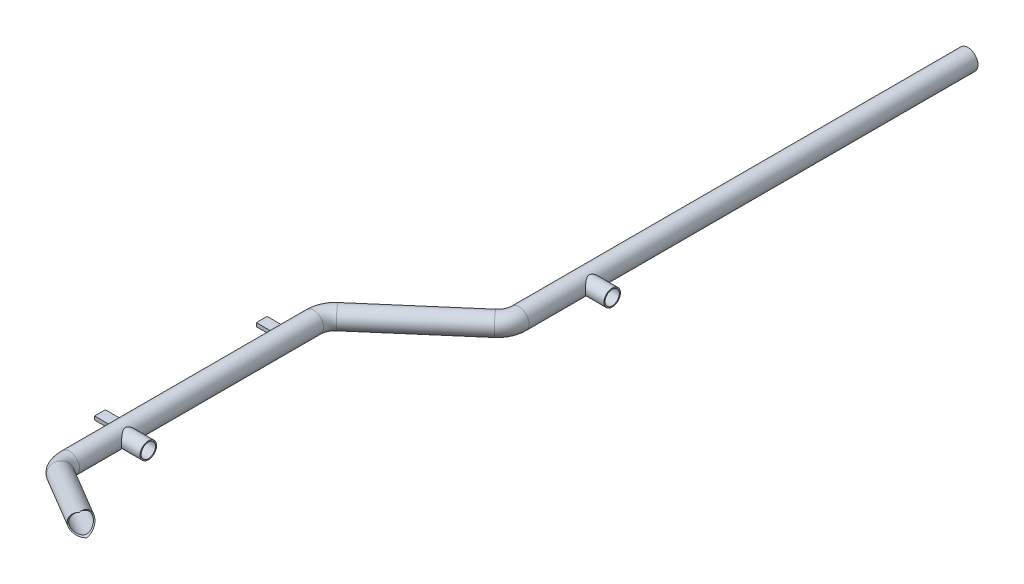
SolidWorks part; units mm, degrees
ref_plane "Plan1" through (0, 0, 0) normal (0, 0, 1) x (1, 0, 0)
ref_plane "Plan2" through (0, 0, 0) normal (0, 1, 0) x (1, 0, 0)
ref_plane "Plan3" through (0, 0, 0) normal (1, 0, 0) x (0, 0, -1)
ref_plane "Plan4" through (146, 0, 0) normal (1, 0, 0) x (0, 0, -1)
ref_plane "Plan5" through (0, 0, -100) normal (0, 0, 1) x (1, 0, 0)
ref_plane "Plan6" through (285, 0, 0) normal (1, 0, 0) x (0, 0, -1)
sketch3d "3DSketch2"
  line L2 (158.0424, 4.4539, -91.0461) -> (242.0268, 35.5159, -28.6006)
  line L3 (146, 0, -115.6534) -> (146, 0, -456.2663)
  line L4 (156.3957, 0, -478.9747) -> (274.6043, 0, -581.0253)
  line L5 (285, 0, -603.7337) -> (285, 0, -1230)
  line L6 (146, 0, -100) -> (280.4925, 49.7426, 0) construction
  arc A0 (146, 0, -115.6534) -> (158.0424, 4.4539, -91.0461) centre (174.1372, 10.4067, -115.6534) ccw
  arc A1 (156.3957, 0, -478.9747) -> (146, 0, -456.2663) centre (176, 0, -456.2663) ccw
  arc A2 (285, 0, -603.7337) -> (274.6043, 0, -581.0253) centre (255, 0, -603.7337) ccw
  point P15 (146, 0, -100)
  point P16 (163.7305, 38.5439, -115.6534)
  point P19 (146, 0, -470)
  point P20 (176, 30, -456.2663)
  point P23 (285, 0, -590)
  point P24 (255, -30, -603.7337)
  dimension "D4" = 30
  dimension "D5" = 30
  dimension "D2" = 30
  dimension "D1" = 370
  dimension "D3" = 129
  dimension "D6" = 409
  dimension "D7" = 50
ref_plane "Plan7" through (0, 0, -1230) normal (0, 0, 1) x (1, 0, 0)
sketch "Esquisse3" plane through (0, 0, -1230) normal (0, 0, 1) x (1, 0, 0)
  circle A0 centre (285, 0) radius 14
  dimension "D1" = 28
sweep "Base-Balayage" add profiles "Esquisse3" path "3DSketch2"
sketch "Esquisse4" plane through (0, 0, -1230) normal (0, 0, 1) x (1, 0, 0)
  circle A2 centre (285, 0) radius 12.5
  circle A3 centre (285, 0) radius 12.5
  dimension "D1" = 1.5
sketch3d "3DSketch3"
  line L2 (158.0424, 4.4539, -91.0461) -> (242.0268, 35.5159, -28.6006)
  line L3 (146, 0, -115.6534) -> (146, 0, -456.2663)
  line L4 (156.3957, 0, -478.9747) -> (274.6043, 0, -581.0253)
  line L5 (285, 0, -603.7337) -> (285, 0, -1230)
  arc A0 (146, 0, -115.6534) -> (158.0424, 4.4539, -91.0461) centre (174.1372, 10.4067, -115.6534) ccw
  arc A1 (156.3957, 0, -478.9747) -> (146, 0, -456.2663) centre (176, 0, -456.2663) ccw
  arc A2 (285, 0, -603.7337) -> (274.6043, 0, -581.0253) centre (255, 0, -603.7337) ccw
  point P15 (146, 0, -100)
  point P16 (163.7305, 38.5439, -115.6534)
  point P19 (146, 0, -470)
  point P20 (176, 30, -456.2663)
  point P23 (285, 0, -590)
  point P24 (255, -30, -603.7337)
  dimension "D4" = 30
  dimension "D5" = 30
  dimension "D2" = 30
  dimension "D1" = 370
  dimension "D3" = 409
  dimension "D6" = 129
sweep "Enlèvement de matière-Balayage1" cut profiles "Esquisse4" path "3DSketch3"
sketch "Esquisse5" plane through (138.4302, 51.199, 102.9279) normal (0.7693, 0.2845, 0.572) x (0.5365, 0.1984, -0.8202)
  circle A1 centre (160.3526, -50.6458) radius 12.5 construction
  circle A2 centre (160.3526, -50.6458) radius 14 construction
  circle A3 centre (160.3526, -50.6458) radius 12.5
  circle A4 centre (160.3526, -50.6458) radius 14
extrude "Boss.-Extru.1" add sketch "Esquisse5" along normal up to surface (34.9909 mm away)
sketch "Esquisse7" plane through (146, 0, 0) normal (1, 0, 0) x (0, 0, -1)
  line L2 (115.6534, 14) -> (115.6534, -14) construction
  circle A0 centre (185.6534, 0) radius 11.5
  circle A1 centre (185.6534, 0) radius 10
  dimension "D2" = 70
  dimension "D1" = 23
  dimension "D3" = 20
extrude "Boss.-Extru.2" add sketch "Esquisse7" along normal blind 40
sketch "Esquisse8" plane through (146, 0, 0) normal (1, 0, 0) x (0, 0, -1)
  line L0 (456.2663, 14) -> (456.2663, -14) construction
  line L1 (200.6534, 4) -> (185.6534, 4)
  line L2 (200.6534, 4) -> (200.6534, -1)
  line L3 (200.6534, -1) -> (185.6534, -1)
  line L4 (185.6534, 4) -> (185.6534, -1)
  line L5 (426.2663, -1) -> (411.2663, -1)
  line L6 (426.2663, -1) -> (426.2663, 4)
  line L7 (426.2663, 4) -> (411.2663, 4)
  line L8 (411.2663, -1) -> (411.2663, 4)
  line L9 (115.6534, 14) -> (115.6534, -14) construction
  line L10 (456.2663, 14) -> (115.6534, 14) construction
  dimension "D1" = 15
  dimension "D2" = 15
  dimension "D3" = 30
  dimension "D4" = 70
  dimension "D5" = 5
  dimension "D6" = 5
  dimension "D7" = 10
extrude "Boss.-Extru.3" add sketch "Esquisse8" against normal blind 35
sketch "Esquisse9" plane through (285, 0, 0) normal (1, 0, 0) x (0, 0, -1)
  line L0 (603.7337, 0) -> (1230, 0) construction
  line L1 (603.7337, 14) -> (603.7337, -14) construction
  circle A0 centre (693.7337, 0) radius 10
  circle A1 centre (693.7337, 0) radius 11.5
  dimension "D1" = 23
  dimension "D2" = 20
  dimension "D3" = 90
extrude "Boss.-Extru.4" add sketch "Esquisse9" along normal blind 40
